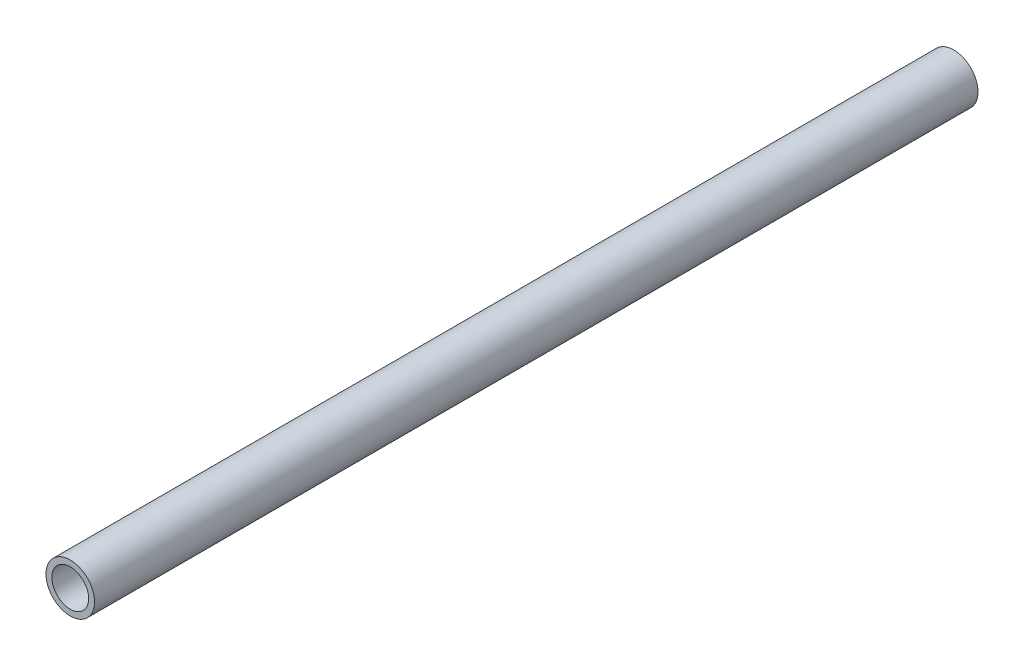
SolidWorks part; units mm, degrees
ref_plane "Plan de face" through (0, 0, 0) normal (0, 0, 1) x (1, 0, 0)
ref_plane "Plan de dessus" through (0, 0, 0) normal (0, 1, 0) x (1, 0, 0)
ref_plane "Plan de droite" through (0, 0, 0) normal (1, 0, 0) x (0, 0, -1)
sketch "Esquisse1" plane through (0, 0, 0) normal (0, 0, 1) x (1, 0, 0)
  circle A0 centre (0, 0) radius 8.25
  circle A1 centre (0, 0) radius 6.25
  dimension "D1" = 16.5
  dimension "D2" = 12.5
extrude "Boss.-Extru.1" add sketch "Esquisse1" along normal blind 300
